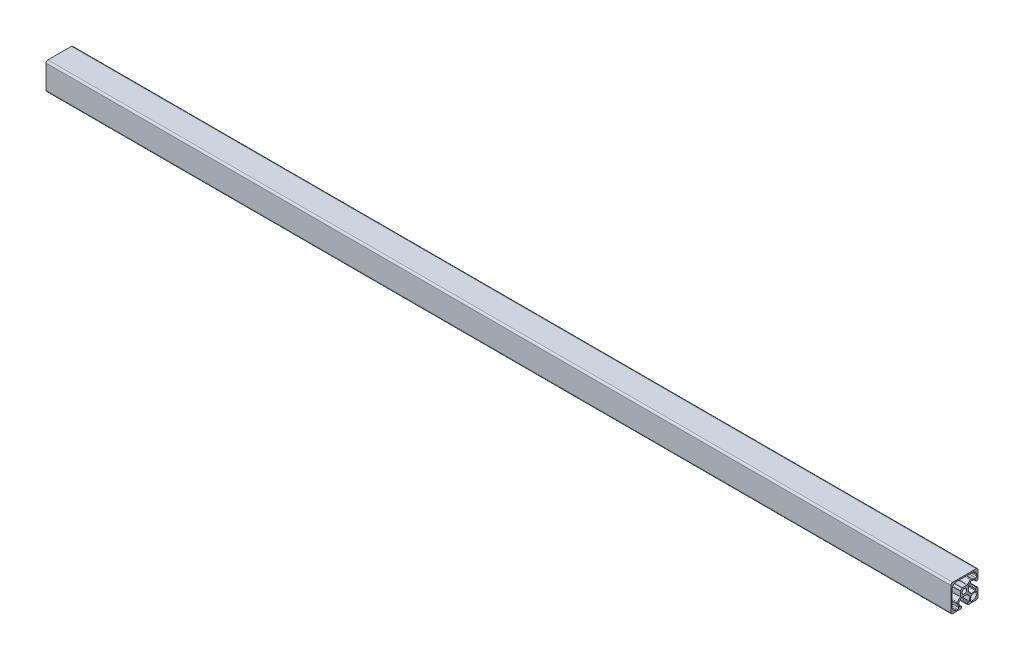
SolidWorks part; units mm, degrees
ref_plane "正面" through (0, 0, 0) normal (0, 0, 1) x (1, 0, 0)
ref_plane "平面" through (0, 0, 0) normal (0, 1, 0) x (1, 0, 0)
ref_plane "右側面" through (0, 0, 0) normal (1, 0, 0) x (0, 0, -1)
sketch "ｽｹｯﾁ1" plane through (0, 0, 0) normal (1, 0, 0) x (0, 0, -1)
  line L0 (-13.5, -9.5592) -> (-13.5, 9.5592)
  line L1 (-15, -13) -> (-15, 13)
  line L2 (4.5, -2.6716) -> (4.5, 2.6716)
  line L3 (-4.5, -2.6716) -> (-4.5, 2.0858)
  line L4 (-9.5592, 13.5) -> (9.5592, 13.5)
  line L5 (3.3787, 4.7929) -> (6.4645, 7.8787)
  line L6 (-13, 15) -> (13, 15)
  line L7 (-4.2071, 2.7929) -> (-2.7929, 4.2071)
  line L8 (-2.0858, 4.5) -> (2.6716, 4.5)
  line L9 (15, 13) -> (15, 4.35)
  line L10 (13.7, 8.9007) -> (13.7, 7.4931)
  line L11 (9.4791, 7.0456) -> (12.5264, 6.5083)
  line L12 (12.5, 3.9) -> (12.5, 4.8748)
  line L13 (4.7929, 3.3787) -> (7.2086, 5.7944)
  line L14 (8.0894, 6.0721) -> (12.0868, 5.3672)
  line L15 (13.8, 3.15) -> (13.25, 3.15)
  line L16 (3.3787, -4.7929) -> (5.7944, -7.2086)
  line L17 (-8.9007, -13.7) -> (-7.4931, -13.7)
  line L18 (-13, -15) -> (-4.35, -15)
  line L19 (-6.0721, -8.0894) -> (-5.3672, -12.0868)
  line L20 (-3.3787, -4.7929) -> (-5.7944, -7.2086)
  line L21 (-4.7929, -3.3787) -> (-7.8787, -6.4645)
  line L22 (-2.6716, -4.5) -> (2.6716, -4.5)
  line L23 (-7.0456, -9.4791) -> (-6.5083, -12.5264)
  line L24 (3.15, -13.25) -> (3.15, -13.8)
  line L25 (-3.15, -13.25) -> (-3.15, -13.8)
  line L26 (-4.8748, -12.5) -> (-3.9, -12.5)
  line L27 (15, -13) -> (15, -4.35)
  line L28 (6.0721, -8.0894) -> (5.3672, -12.0868)
  line L29 (13.7, -8.9007) -> (13.7, -7.4931)
  line L30 (9.4791, -7.0456) -> (12.5264, -6.5083)
  line L31 (4.7929, -3.3787) -> (7.2086, -5.7944)
  line L32 (8.0894, -6.0721) -> (12.0868, -5.3672)
  line L33 (12.5, -3.9) -> (12.5, -4.8748)
  line L34 (13.8, -3.15) -> (13.25, -3.15)
  line L35 (7.0456, -9.4791) -> (6.5083, -12.5264)
  line L36 (8.9007, -13.7) -> (7.4931, -13.7)
  line L37 (4.8748, -12.5) -> (3.9, -12.5)
  line L38 (13, -15) -> (4.35, -15)
  circle A0 centre (0, 0) radius 2.55
  arc A1 (-13, 15) -> (-15, 13) centre (-13, 13) ccw
  arc A2 (-9.5592, 13.5) -> (-9.9141, 13.4349) centre (-9.5592, 12.5) ccw
  arc A3 (-9.9141, 13.4349) -> (-13.4349, 9.9141) centre (-7.76, 7.76) ccw
  arc A4 (-13.4349, 9.9141) -> (-13.5, 9.5592) centre (-12.5, 9.5592) ccw
  arc A5 (2.6716, 4.5) -> (3.3787, 4.7929) centre (2.6716, 5.5) ccw
  arc A6 (-2.0858, 4.5) -> (-2.7929, 4.2071) centre (-2.0858, 3.5) ccw
  arc A7 (-4.2071, 2.7929) -> (-4.5, 2.0858) centre (-3.5, 2.0858) ccw
  arc A8 (15, 13) -> (13, 15) centre (13, 13) ccw
  arc A9 (13.8, 3.15) -> (15, 4.35) centre (13.8, 4.35) ccw
  arc A10 (12.5264, 6.5083) -> (13.7, 7.4931) centre (12.7, 7.4931) ccw
  arc A11 (7.8787, 7.8787) -> (9.4791, 7.0456) centre (10, 10) ccw
  arc A12 (7.8787, 7.8787) -> (6.4645, 7.8787) centre (7.1716, 7.1716) ccw
  arc A13 (9.9141, 13.4349) -> (9.5592, 13.5) centre (9.5592, 12.5) ccw
  arc A14 (13.6744, 9.1257) -> (9.9141, 13.4349) centre (7.76, 7.76) ccw
  arc A15 (13.7, 8.9007) -> (13.6744, 9.1257) centre (12.7, 8.9007) ccw
  arc A16 (4.7929, 3.3787) -> (4.5, 2.6716) centre (5.5, 2.6716) ccw
  arc A17 (12.5, 3.9) -> (13.25, 3.15) centre (13.25, 3.9) ccw
  arc A18 (12.5, 4.8748) -> (12.0868, 5.3672) centre (12, 4.8748) ccw
  arc A19 (8.0894, 6.0721) -> (7.2086, 5.7944) centre (7.9157, 5.0873) ccw
  arc A20 (3.15, -13.8) -> (4.35, -15) centre (4.35, -13.8) ccw
  arc A21 (3.9, -12.5) -> (3.15, -13.25) centre (3.9, -13.25) ccw
  arc A22 (-7.8787, -6.4645) -> (-7.8787, -7.8787) centre (-7.1716, -7.1716) ccw
  arc A23 (-13.5, -9.5592) -> (-13.4349, -9.9141) centre (-12.5, -9.5592) ccw
  arc A24 (-13.4349, -9.9141) -> (-9.1257, -13.6744) centre (-7.76, -7.76) ccw
  arc A25 (-9.1257, -13.6744) -> (-8.9007, -13.7) centre (-8.9007, -12.7) ccw
  arc A26 (-15, -13) -> (-13, -15) centre (-13, -13) ccw
  arc A27 (-7.0456, -9.4791) -> (-7.8787, -7.8787) centre (-10, -10) ccw
  arc A28 (3.3787, -4.7929) -> (2.6716, -4.5) centre (2.6716, -5.5) ccw
  arc A29 (-2.6716, -4.5) -> (-3.3787, -4.7929) centre (-2.6716, -5.5) ccw
  arc A30 (-4.7929, -3.3787) -> (-4.5, -2.6716) centre (-5.5, -2.6716) ccw
  arc A31 (-5.7944, -7.2086) -> (-6.0721, -8.0894) centre (-5.0873, -7.9157) ccw
  arc A32 (-7.4931, -13.7) -> (-6.5083, -12.5264) centre (-7.4931, -12.7) ccw
  arc A33 (-4.35, -15) -> (-3.15, -13.8) centre (-4.35, -13.8) ccw
  arc A34 (-5.3672, -12.0868) -> (-4.8748, -12.5) centre (-4.8748, -12) ccw
  arc A35 (-3.15, -13.25) -> (-3.9, -12.5) centre (-3.9, -13.25) ccw
  arc A36 (15, -4.35) -> (13.8, -3.15) centre (13.8, -4.35) ccw
  arc A37 (13, -15) -> (15, -13) centre (13, -13) ccw
  arc A38 (9.1257, -13.6744) -> (13.6744, -9.1257) centre (7.76, -7.76) ccw
  arc A39 (9.4791, -7.0456) -> (7.0456, -9.4791) centre (10, -10) ccw
  arc A40 (13.6744, -9.1257) -> (13.7, -8.9007) centre (12.7, -8.9007) ccw
  arc A41 (13.7, -7.4931) -> (12.5264, -6.5083) centre (12.7, -7.4931) ccw
  arc A42 (4.5, -2.6716) -> (4.7929, -3.3787) centre (5.5, -2.6716) ccw
  arc A43 (6.0721, -8.0894) -> (5.7944, -7.2086) centre (5.0873, -7.9157) ccw
  arc A44 (7.2086, -5.7944) -> (8.0894, -6.0721) centre (7.9157, -5.0873) ccw
  arc A45 (12.0868, -5.3672) -> (12.5, -4.8748) centre (12, -4.8748) ccw
  arc A46 (13.25, -3.15) -> (12.5, -3.9) centre (13.25, -3.9) ccw
  arc A47 (6.5083, -12.5264) -> (7.4931, -13.7) centre (7.4931, -12.7) ccw
  arc A48 (8.9007, -13.7) -> (9.1257, -13.6744) centre (8.9007, -12.7) ccw
  arc A49 (4.8748, -12.5) -> (5.3672, -12.0868) centre (4.8748, -12) ccw
extrude "ﾎﾞｽ - 押し出し1" add sketch "ｽｹｯﾁ1" along normal blind 1000
